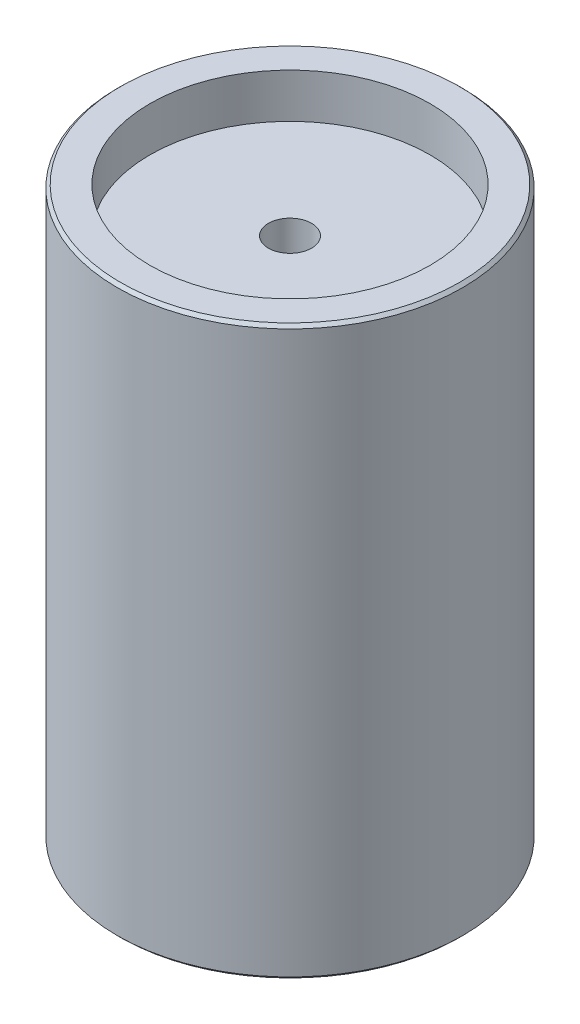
SolidWorks part; units mm, degrees
ref_plane "Front Plane" through (0, 0, 0) normal (0, 0, 1) x (1, 0, 0)
ref_plane "Top Plane" through (0, 0, 0) normal (0, 1, 0) x (1, 0, 0)
ref_plane "Right Plane" through (0, 0, 0) normal (1, 0, 0) x (0, 0, -1)
sketch "Sketch1" plane through (0, 0, 0) normal (0, 0, 1) x (1, 0, 0)
  line L0 (0, 0) -> (0, -146.05) construction
  line L1 (0, -146.05) -> (43.6563, -146.05)
  line L2 (44.45, -145.2562) -> (44.45, 0)
  line L3 (44.45, 0) -> (36.068, 0)
  line L4 (36.068, 0) -> (36.068, -11.43)
  line L10 (0, -11.43) -> (0, -146.05)
  line L11 (0, 0) -> (36.068, 0) construction
  line L12 (36.068, -11.43) -> (0, -11.43)
  line L14 (43.6563, -146.05) -> (44.45, -145.2562)
  dimension "D13" = 0.7937
  dimension "D2" = 146.05
  dimension "D4" = 44.45
  dimension "D5" = 36.068
  dimension "D11" = 11.43
  dimension "D14" = 0.7937
revolve "Revolve1" add sketch "Sketch1" angle 360 about L0
chamfer "Chamfer1" distance 0.7874 angle 45 1 edges at (-44.45, 0, 0)
sketch "Sketch3" plane through (0, -146.05, 0) normal (0, -1, 0) x (1, 0, 0)
  circle A0 centre (0, 0) radius 12.7
  dimension "D1" = 25.4
extrude "Cut-Extrude2" cut sketch "Sketch3" against normal blind 1.27
hole_wizard "7/16-20 Tapped Hole1" positions "3DSketch1" profile "Sketch4" tap size "7/16-20" standard "Ansi Inch"
sketch3d "3DSketch1"
  circle A0 centre (0, -144.78, 0) radius 12.7 construction
  point P8 (0, -144.78, 0)
  point P14 (0, -157.48, 0)
sketch "Sketch4" plane through (0, -144.78, 0) normal (1, 0, 0) x (0, 0, -1)
  line L0 (0, 0) -> (0, 144.78)
  line L1 (0, 144.78) -> (5.5562, 144.78)
  line L2 (5.5562, 144.78) -> (5.5562, 0)
  line L5 (5.5562, 0) -> (0, 0)
  line L11 (0, -6.35) -> (0, 107.95) construction
  dimension "Thread Major Dia." = 11.1125
  dimension "Thru Tap Drill Depth" = 144.78
sketch "Sketch7" plane through (0, -146.05, 0) normal (0, -1, 0) x (1, 0, 0)
  line L0 (0, 0) -> (0, 31.75) construction
  dimension "D1" = 31.75
hole_wizard "#10-32 Tapped Hole1" positions "3DSketch3" profile "Sketch8" tap size "#10-32" standard "Ansi Inch"
sketch3d "3DSketch3"
  point P0 (0, -146.05, 31.75)
sketch "Sketch8" plane through (0, -146.05, 31.75) normal (1, 0, 0) x (0, 0, -1)
  line L0 (0, 0) -> (0, 11.3733)
  line L1 (0, 11.3733) -> (2.0193, 10.16)
  line L2 (2.0193, 10.16) -> (2.0193, 8.89)
  line L3 (2.0193, 8.89) -> (2.413, 8.89)
  line L4 (2.413, 8.89) -> (2.413, 0)
  line L5 (2.413, 0) -> (0, 0)
  line L10 (0, 11.3733) -> (-2.0193, 10.16) construction
  line L11 (0, -6.35) -> (0, 107.95) construction
  dimension "Tap Drill Dia." = 4.0386
  dimension "Tap Drill Depth" = 10.16
  dimension "Thread Major Dia." = 4.826
  dimension "Thread Depth" = 8.89
  dimension "Drill Angle" = 118
